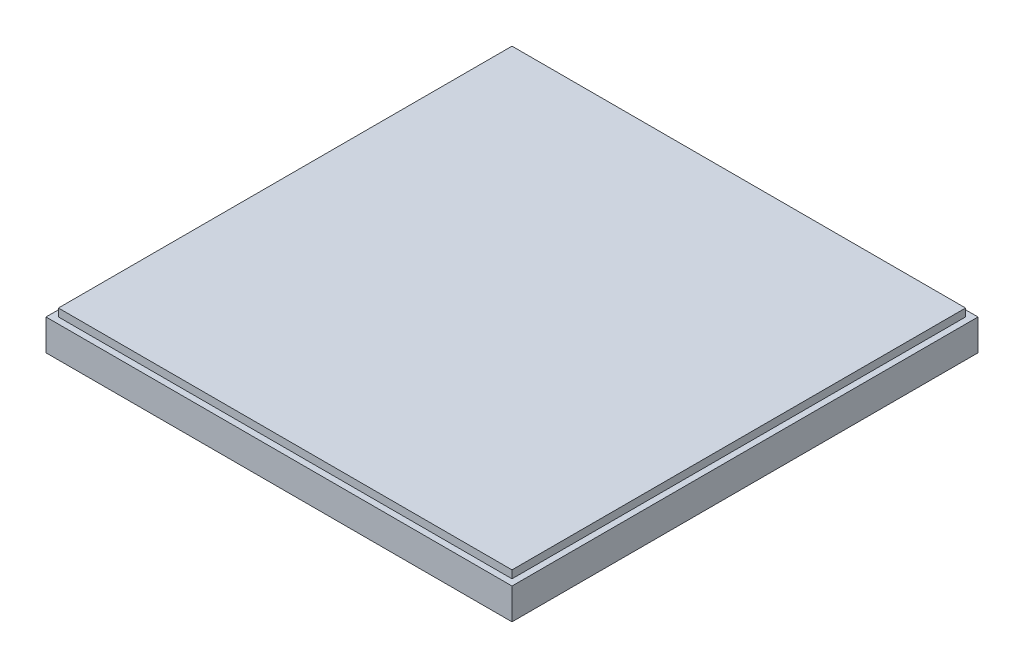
SolidWorks part; units mm, degrees
ref_plane "前视基准面" through (0, 0, 0) normal (0, 0, 1) x (1, 0, 0)
ref_plane "上视基准面" through (0, 0, 0) normal (0, 1, 0) x (1, 0, 0)
ref_plane "右视基准面" through (0, 0, 0) normal (1, 0, 0) x (0, 0, -1)
sketch "草图1" plane through (0, 0, 0) normal (0, 1, 0) x (1, 0, 0)
  line L0 (30, 30) -> (30, -30)
  line L1 (30, 30) -> (-30, 30)
  line L2 (30, -30) -> (-30, -30)
  line L3 (-30, 30) -> (-30, -30)
  line L4 (30, 30) -> (-30, -30) construction
  line L5 (30, -30) -> (-30, 30) construction
  point P1 (0, 0)
  dimension "D1" = 60
  dimension "D2" = 60
extrude "凸台-拉伸1" add sketch "草图1" along normal blind 4
sketch "草图2" plane through (0, 4, 0) normal (0, 1, 0) x (1, 0, 0)
  line L0 (29, 29) -> (29, -29)
  line L1 (29, 29) -> (-29, 29)
  line L2 (29, -29) -> (-29, -29)
  line L3 (-29, 29) -> (-29, -29)
  line L4 (29, 29) -> (-29, -29) construction
  line L5 (29, -29) -> (-29, 29) construction
  point P1 (0, 0)
  dimension "D1" = 58
  dimension "D2" = 58
extrude "切除-拉伸1" cut sketch "草图2" against normal blind 2
sketch "草图4" plane through (0, 2, 0) normal (0, 1, 0) x (1, 0, 0)
  line L0 (29, 29) -> (-29, 29) construction
  line L1 (-25, 27) -> (25, 27)
  line L2 (-25, 27) -> (-25, -22.5)
  line L3 (-25, -22.5) -> (25, -22.5)
  line L4 (25, 27) -> (25, -22.5)
  line L5 (-29, -29) -> (29, -29) construction
  line L6 (-29, 29) -> (-29, -29) construction
  line L7 (29, -29) -> (29, 29) construction
  dimension "D1" = 2
  dimension "D2" = 6.5
  dimension "D3" = 4
  dimension "D4" = 4
extrude "凸台-拉伸2" add sketch "草图4" along normal blind 0.2
chamfer "倒角1" distance 1 angle 45 1 edges at (25, 2.1, 22.5)
sketch "草图6" plane through (0, 2.2, 0) normal (0, 1, 0) x (1, 0, 0)
  line L3 (-0.5, 27) -> (-0.5, -22.5)
  line L4 (0.5, 27) -> (0.5, -22.5)
  line L5 (-0.5, 27) -> (0.5, 27)
  line L6 (-0.5, -22.5) -> (0.5, -22.5)
extrude "凸台-拉伸3" add sketch "草图6" along normal blind 0.1
sketch "草图8" plane through (0, 2.2, 0) normal (0, 1, 0) x (1, 0, 0)
  line L0 (-25, 24.8) -> (24, 24.8)
  line L1 (-25, 27) -> (-25, -22.5) construction
  line L2 (24, 24.8) -> (24, 24.6)
  line L3 (24, 24.6) -> (-25, 24.6)
  line L4 (-25, 27) -> (-25, -22.5) construction
  line L5 (-25, 24.6) -> (-25, 24.8)
  line L6 (-0.5, 27) -> (-25, 27) construction
  line L7 (25, -21.5) -> (25, 27) construction
  dimension "D1" = 2.2
  dimension "D2" = 0.2
  dimension "D3" = 1
extrude "凸台-拉伸4" add sketch "草图8" along normal blind 0.1
pattern_linear "阵列(线性)1" count 22 spacing 2.2 along (0, 0, 1) of "凸台-拉伸4"
sketch "草图9" plane through (0, 2, 0) normal (0, 1, 0) x (1, 0, 0)
  line L0 (-25, -22.5) -> (24, -22.5) construction
  line L1 (-0.5, -22.5) -> (0.5, -22.5)
  line L2 (-0.5, -22.5) -> (-0.5, -29)
  line L3 (-0.5, -29) -> (0.5, -29)
  line L4 (0.5, -22.5) -> (0.5, -29)
  line L5 (-29, -29) -> (29, -29) construction
  dimension "D1" = 1
extrude "凸台-拉伸5" add sketch "草图9" along normal blind 0.4
sketch "草图10" plane through (0, 2, 0) normal (0, 1, 0) x (1, 0, 0)
  line L0 (-25, -22.5) -> (-0.5, -22.5) construction
  line L1 (-2.5, -22.5) -> (-1.5, -22.5)
  line L2 (-2.5, -22.5) -> (-2.5, -29)
  line L3 (-2.5, -29) -> (-1.5, -29)
  line L4 (-1.5, -22.5) -> (-1.5, -29)
  line L5 (-29, -29) -> (29, -29) construction
  line L6 (-0.5, -22.5) -> (-0.5, -29) construction
  dimension "D1" = 1
  dimension "D2" = 1
extrude "凸台-拉伸6" add sketch "草图10" along normal blind 0.1
sketch "草图11" plane through (0, 4, 0) normal (0, 1, 0) x (1, 0, 0)
  line L0 (30, 30) -> (-30, 30) construction
  line L1 (-29.2, 29.2) -> (29.2, 29.2)
  line L2 (-29.2, 29.2) -> (-29.2, -29.2)
  line L3 (-29.2, -29.2) -> (29.2, -29.2)
  line L4 (29.2, 29.2) -> (29.2, -29.2)
  line L5 (-30, 30) -> (-30, -30) construction
  line L6 (30, -30) -> (30, 30) construction
  line L7 (-30, -30) -> (30, -30) construction
  dimension "D1" = 0.8
  dimension "D2" = 0.8
  dimension "D3" = 0.8
  dimension "D4" = 0.8
extrude "凸台-拉伸7" add sketch "草图11" along normal blind 1
